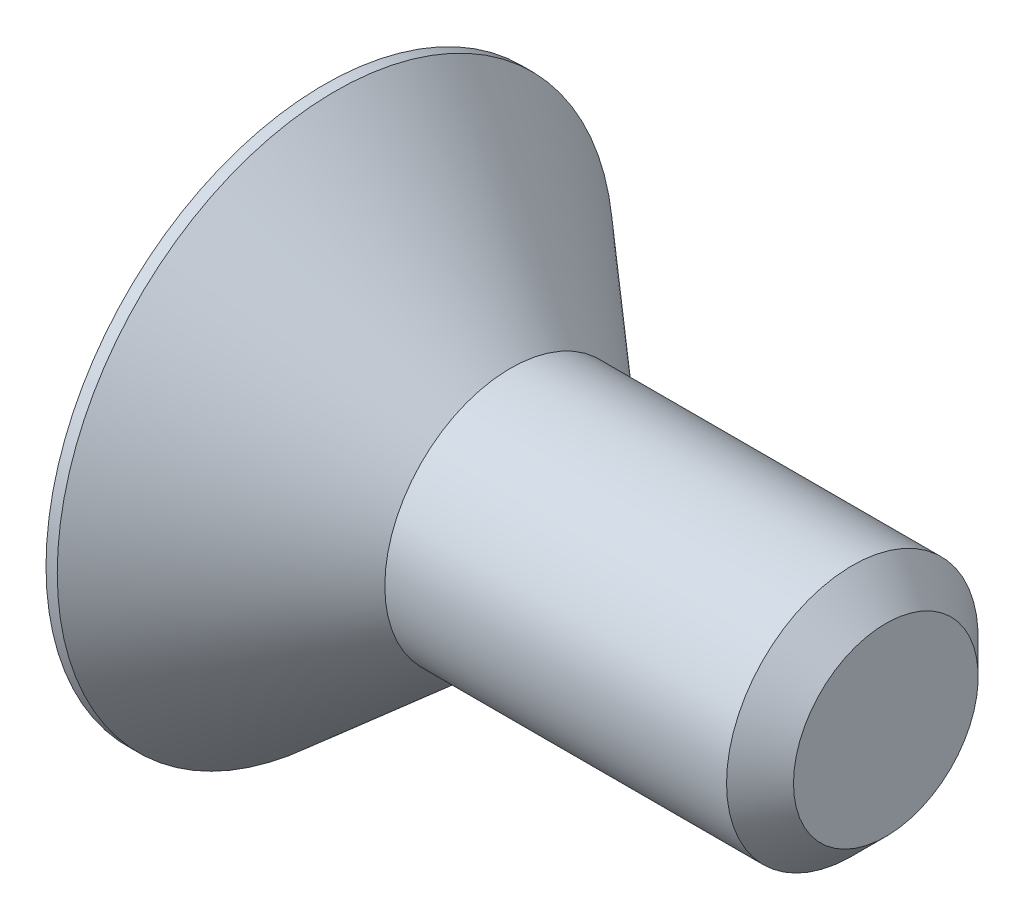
SolidWorks part; units mm, degrees
revolve "PreBroach" cut sketch "Sketch2"
sketch "Sketch2"
  line L0 (0, 0.7938) -> (1.397, 0.7938)
  line L1 (1.397, 0.7938) -> (1.8553, 0)
  line L2 (0, 0) -> (127, 0) construction
  line L3 (1.8553, 0) -> (0, 0)
  line L4 (0, 0) -> (0, 0.7938)
  line L5 (0, -0.7938) -> (1.397, -0.7938) construction
  line L6 (0, 0) -> (47.625, 0) construction
  line L8 (0, 3.1445) -> (0, -3.1445) construction
revolve "BaseBody" add sketch "BodySke" angle 360 about L6
sketch "BodySke" plane through (0, 0, 0) normal (0, 0, 1) x (1, 0, 0)
  line L0 (0, 0) -> (0, 3.1445)
  line L1 (0.127, 3.1445) -> (2.1081, 1.4224)
  line L2 (0, 3.1445) -> (0.127, 3.1445)
  line L3 (2.1081, 1.4224) -> (5.9715, 1.4224)
  line L4 (6.35, 1.0439) -> (6.35, 0)
  line L5 (6.35, 0) -> (0, 0)
  line L6 (0, 0) -> (127, 0) construction
  line L7 (0.127, -3.1445) -> (2.1081, -1.4224) construction
  line L8 (6.35, 1.0439) -> (5.9715, 1.4224)
  line L9 (0, -3.1445) -> (0.127, -3.1445) construction
  line L10 (6.35, -1.0439) -> (5.9715, -1.4224) construction
  line L11 (2.7431, 7.7724) -> (2.7431, -14.4526) construction
  line L12 (0, 19.05) -> (0, -3.175) construction
ref_plane "Plane1" through (0, 0, 0) normal (0, 0, 1) x (1, 0, 0)
ref_plane "Plane2" through (0, 0, 0) normal (0, 1, 0) x (1, 0, 0)
ref_plane "Plane3" through (0, 0, 0) normal (1, 0, 0) x (0, 0, -1)
sketch "Sketch3" plane through (0, 0, 0) normal (-1, 0, 0) x (0, 0, 1)
  line L0 (-0.7937, -0.4583) -> (-0.7937, 0.4583)
  line L1 (-0.7937, 0.4583) -> (0, 0.9165)
  line L2 (0, 0.9165) -> (0.7937, 0.4583)
  line L3 (0.7937, 0.4583) -> (0.7937, -0.4583)
  line L4 (0.7937, -0.4583) -> (0, -0.9165)
  line L5 (0, -0.9165) -> (-0.7937, -0.4583)
extrude "Hex" cut sketch "Sketch3" against normal blind 1.397
sketch "Sketch4" plane through (0, 0, 0) normal (-1, 0, 0) x (0, 0, 1)
  line L0 (0, 0) -> (0.9398, 0)
  line L1 (0, 0) -> (6.1484, 3.5498) construction
  line L2 (0, 0) -> (0.4699, 0.8139)
  line L3 (0.7832, 0.2175) -> (0.8962, 0.2828)
  line L4 (0.58, 0.5695) -> (0.693, 0.6348)
  arc A0 (0.7832, 0.2175) -> (0.58, 0.5695) centre (0, 0) ccw
  arc A1 (0.9398, 0) -> (0.8962, 0.2828) centre (0, 0) ccw
  arc A2 (0.4699, 0.8139) -> (0.693, 0.6348) centre (0, 0) cw
extrude "Spline" [suppressed] cut sketch "Sketch4" against normal blind 1.397
pattern_circular "CirPattern1" [suppressed] count 6 every 60 about axis through (0, 0, 0) along (1, 0, 0)
sketch "ThdSchSke" plane through (0, 0, 0) normal (0, 0, 1) x (1, 0, 0)
  line L0 (2.6161, -1.0439) -> (2.3511, -1.4224)
  line L1 (2.6161, -1.0439) -> (2.8811, -1.4224)
  line L2 (2.8811, -1.4224) -> (2.8811, -1.778)
  line L3 (-3.175, 0) -> (5.1513, 0) construction
  line L4 (0, 3.1445) -> (0, -3.1445) construction
  line L5 (2.8811, -1.778) -> (2.3511, -1.778)
  line L6 (2.3511, -1.778) -> (2.3511, -1.4224)
revolve "ThreadSchematic" [suppressed] cut sketch "ThdSchSke" angle 360 about L3
pattern_linear "ThdSchPat" [suppressed]
equation "\"D3@Sketch4\" = \"Spline_p_dim@Sketch4\" / 2"
equation "\"Thread_minor@ThreadCosmetic\"  =  \"Minor_dia@BodySke\""
equation "\"D2@CirPattern1\" = 360 / \"Num_teeth@CirPattern1\""
equation "\"D1@Sketch3\" = \"Hex_size@Sketch3\" / 2"
equation "\"D2@Sketch3\" = \"D1@Sketch3\""
equation "\"D3@Sketch3\" = \"Hex_size@Sketch3\""
equation "\"Thread_length@ThreadCosmetic\" = ((sgn( (\"Length@BodySke\" - \"Advance@BodySke\" - ( ( ( \"Head_dia@BodySke\" - \"Diameter@BodySke\" ) * 0.5 ) / tan( \"Head_ang@BodySke\" * 0.008726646 ) ) ) - \"Thread_nom@Body"
equation "\"Thread_minor@ThdSchSke\" = \"Minor_dia@BodySke\""
equation "\"Diameter@ThdSchSke\" = \"Diameter@BodySke\""
equation "\"Overcut@ThdSchSke\" = \"Diameter@BodySke\" * 1.25"
equation "\"Start@ThdSchSke\" = 0.000001 + \"Length@BodySke\" - \"Thread_length@ThreadCosmetic\"  '---Countersunk---"
equation "\"Num_threads@ThdSchPat\" = int( \"Thread_length@ThreadCosmetic\" / \"Advance@BodySke\" + 0.999 )  + 1"
equation "\"Advance@ThdSchPat\" = \"Thread_length@ThreadCosmetic\" /  (\"Num_threads@ThdSchPat\" - 1) 'relax it"
equation "\"Num_threads@ThdSchPat\" = \"Num_threads@ThdSchPat\" - sgn( \"Num_threads@ThdSchPat\" - 1) '---chamfered tips only---"
